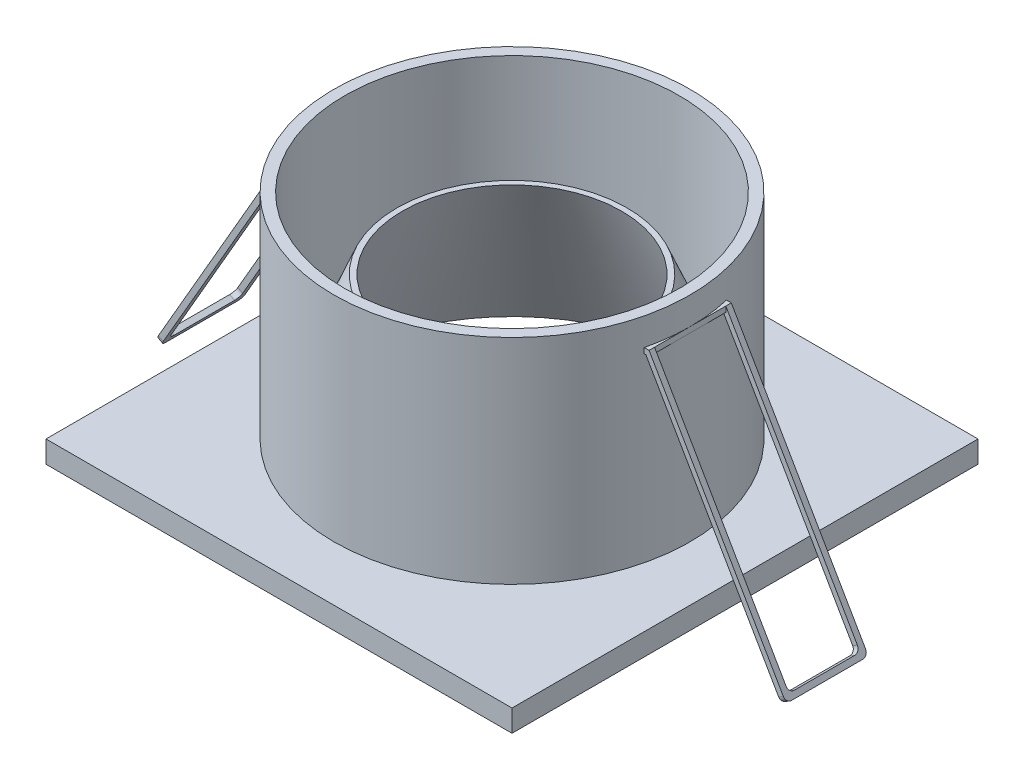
SolidWorks part; units mm, degrees
ref_plane "Alzado" through (0, 0, 0) normal (0, 0, 1) x (1, 0, 0)
ref_plane "Planta" through (0, 0, 0) normal (0, 1, 0) x (1, 0, 0)
ref_plane "Vista lateral" through (0, 0, 0) normal (1, 0, 0) x (0, 0, -1)
sketch "Croquis1" plane through (0, 0, 0) normal (0, 1, 0) x (1, 0, 0)
  line L1 (0, 0) -> (85, 0)
  line L2 (0, 0) -> (0, 85)
  line L3 (0, 85) -> (85, 85)
  line L4 (85, 0) -> (85, 85)
  dimension "D1" = 85
  dimension "D2" = 85
extrude "Saliente-Extruir1" add sketch "Croquis1" along normal blind 4
sketch "Croquis2" plane through (0, 4, 0) normal (0, 1, 0) x (1, 0, 0)
  line L0 (42.5, 85) -> (42.5, 0) construction
  line L1 (85, 85) -> (0, 85) construction
  line L2 (0, 0) -> (85, 0) construction
  circle A0 centre (42.5, 42.5) radius 32.5
extrude "Saliente-Extruir2" add sketch "Croquis2" along normal blind 39
sketch "Croquis3" plane through (0, 43, 0) normal (0, 1, 0) x (1, 0, 0)
  circle A2 centre (42.5, 42.5) radius 30.5
  circle A3 centre (42.5, 42.5) radius 30.5
  dimension "D1" = 2
extrude "Cortar-Extruir1" cut sketch "Croquis3" against normal blind 39
ref_plane "Plano1" through (0, 30, 0) normal (0, -1, 0) x (-1, 0, 0)
sketch "Croquis4" plane through (0, 30, 0) normal (0, -1, 0) x (-1, 0, 0)
  circle A0 centre (-42.5, 42.5) radius 21
sketch "Croquis5" plane through (0, 0, 0) normal (0, -1, 0) x (1, 0, 0)
  circle A0 centre (42.5, -42.5) radius 34
loft "Recubrir1" add profiles "Croquis5", "Croquis4"
sketch "Croquis6" plane through (0, 30, 0) normal (0, 1, 0) x (1, 0, 0)
  circle A2 centre (42.5, 42.5) radius 20
  circle A3 centre (42.5, 42.5) radius 20
  dimension "D1" = 1
sketch "Croquis7" plane through (0, 0, 0) normal (0, -1, 0) x (1, 0, 0)
  circle A0 centre (42.5, -42.5) radius 33
loft "Cortar-Recubrir2" cut profiles "Croquis7", "Croquis6"
ref_plane "Plano2" through (75, 0, 0) normal (1, 0, 0) x (0, 0, -1)
sketch "Croquis8" plane through (75, 0, 0) normal (1, 0, 0) x (0, 0, -1)
  line L0 (42.5, 43) -> (42.5, 4) construction
  line L1 (75, 43) -> (10, 43) construction
  line L2 (0, 4) -> (85, 4) construction
  line L3 (42.5, 43) -> (42.5, 38) construction
  line L4 (50, 38) -> (35, 38)
  line L5 (35, 38) -> (35, 37)
  line L6 (35, 37) -> (50, 37)
  line L7 (50, 37) -> (50, 38)
  point P10 (42.5, 38)
extrude "Saliente-Extruir3" add sketch "Croquis8" against normal up to next
ref_plane "Plano3" through (72.7045, 41.976, 0) normal (0.866, 0.5, 0) x (0, 0, 1)
sketch "Croquis9" plane through (72.7045, 41.976, 0) normal (0.866, 0.5, 0) x (0, 0, 1)
  line L0 (-50, 4.591) -> (-50, 53.591)
  line L1 (-35, 4.591) -> (-35, 53.591)
  line L2 (-36, 54.591) -> (-49, 54.591)
  line L3 (-49, 4.591) -> (-49, 52.591)
  line L4 (-37, 53.591) -> (-48, 53.591)
  line L5 (-36, 4.591) -> (-36, 52.591)
  line L6 (-50, 4.591) -> (-49, 4.591)
  line L7 (-49, 4.591) -> (-35, 4.591)
  line L8 (-36, 53.591) -> (-49, 53.591) construction
  line L9 (-36, 4.591) -> (-36, 53.591) construction
  line L10 (-49, 4.591) -> (-49, 53.591) construction
  line L11 (-35, 4.591) -> (-35, 54.591) construction
  line L12 (-35, 54.591) -> (-50, 54.591) construction
  line L13 (-50, 4.591) -> (-50, 54.591) construction
  arc A0 (-37, 53.591) -> (-36, 52.591) centre (-37, 52.591) cw
  arc A1 (-48, 53.591) -> (-49, 52.591) centre (-48, 52.591) ccw
  arc A2 (-35, 53.591) -> (-36, 54.591) centre (-36, 53.591) ccw
  arc A3 (-50, 53.591) -> (-49, 54.591) centre (-49, 53.591) cw
  point P2 (0, 0)
  point P24 (0, 0)
  point P25 (-50, 4.5854)
  dimension "D3" = 1
  dimension "D1" = 13
  dimension "D2" = 1
  dimension "D4" = 50
extrude "Saliente-Extruir4" add sketch "Croquis9" against normal blind 1 contours A3 L0 L6 L3 A1 L4 A0 L5 L7 L1 A2 L2
ref_plane "Plano4" through (42.5, 0, 0) normal (1, 0, 0) x (0, 0, -1)
mirror "Simetría1" about plane through (42.5, 0, 0) normal (1, 0, 0) of "Saliente-Extruir3", "Saliente-Extruir4"
